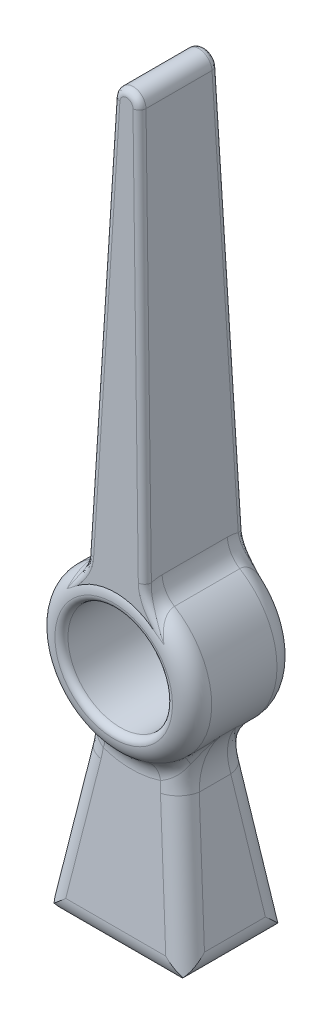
SolidWorks part; units mm, degrees
ref_plane "Спереди" through (0, 0, 0) normal (0, 0, 1) x (1, 0, 0)
ref_plane "Сверху" through (0, 0, 0) normal (0, 1, 0) x (1, 0, 0)
ref_plane "Справа" through (0, 0, 0) normal (1, 0, 0) x (0, 0, -1)
sketch "Эскиз1" plane through (0, 0, 0) normal (0, 0, 1) x (1, 0, 0)
  circle A0 centre (0, 0) radius 4 construction
  circle A1 centre (0, 0) radius 6
  dimension "D1" = 8
  dimension "D2" = 12
extrude "Бобышка-Вытянуть1" add sketch "Эскиз1" along normal mid plane 8
fillet "Скругление1" radius 1.5 2 edges at (6, 0, -4) (6, 0, 4)
sketch "Эскиз3" plane through (0, 0, 0) normal (0, 0, 1) x (1, 0, 0)
  line L0 (0, 0) -> (0, 38) construction
  line L1 (2.471, 0) -> (-2.471, 0)
  line L2 (-2.471, 0) -> (-0.9992, 37.0397)
  line L3 (-2.25, 5.5621) -> (0, 5.5621) construction
  line L4 (2.471, 0) -> (0.9992, 37.0397)
  circle A0 centre (0, 0) radius 6 construction
  circle A1 centre (0, 0) radius 6 construction
  arc A2 (0.9992, 37.0397) -> (-0.9992, 37.0397) centre (0, 37) ccw
  dimension "D1" = 2
  dimension "D2" = 38
  dimension "D3" = 4.5
extrude "Бобышка-Вытянуть2" add sketch "Эскиз3" along normal mid plane 8 separate body
sketch "Эскиз4" plane through (0, 0, 0) normal (1, 0, 0) x (0, 0, -1)
  line L0 (-4, 0) -> (-3, 38)
  line L1 (-4, 4.5) -> (-4, -4.5) construction
  line L2 (4, 38) -> (-4, 38) construction
  line L3 (-3, 38) -> (-4, 38)
  line L4 (-4, 38) -> (-4, 0)
  line L5 (0, 0) -> (0, 38) construction
  line L6 (4, 0) -> (3, 38)
  line L7 (4, 38) -> (4, 0)
  line L8 (3, 38) -> (4, 38)
  dimension "D1" = 6
extrude "Вырез-Вытянуть1" cut sketch "Эскиз4" against normal mid plane 8
combine bodies "Соединить1" operation type add bodies to combine 104 101
fillet "Скругление3" radius 2 3 edges at (2.25, 5.5621, 0) (2.2622, 5.2554, -3.3704) (2.2642, 5.2036, 3.4326)
fillet "Скругление4" radius 2 3 edges at (-2.25, 5.5621, 0) (-2.2642, 5.2036, -3.4326) (-2.2622, 5.2554, 3.3704)
fillet "Скругление5" radius 0.5 10 edges at (2.4238, 5.4513, -3.8565) (-2.4372, 5.417, -3.8574) (-1.6078, 21.7242, -3.4283) (0, 38, -3) (-2.4238, 5.4513, 3.8565) (-1.6078, 21.7242, 3.4283) (0, 38, 3) (2.4372, 5.417, 3.8574) (1.6078, 21.7242, -3.4283) (1.6078, 21.7242, 3.4283)
sketch "Эскиз5" plane through (0, 0, 0) normal (1, 0, 0) x (0, 0, -1)
  line L0 (-4, 4.5) -> (-4, -4.5) construction
  line L1 (-4, -18.3693) -> (-1.7724, 0)
  line L2 (0, 0) -> (0, -19) construction
  line L3 (-1.7724, 0) -> (1.7724, 0)
  line L4 (4, -18.3693) -> (1.7724, 0)
  line L6 (-2.5, -6) -> (2.5, -6) construction
  arc A0 (-4, -18.3693) -> (4, -18.3693) centre (0, -6) ccw
  point P8 (-2.5, -6)
  dimension "D1" = 13
  dimension "D3" = 19
extrude "Бобышка-Вытянуть3" add sketch "Эскиз5" along normal mid plane 11 separate body
sketch "Эскиз7" plane through (0, 0, 0) normal (0, 0, 1) x (1, 0, 0)
  line L0 (-5.5, -18.1865) -> (-3.7552, -7.555)
  line L1 (-2.5153, 0) -> (2.5153, 0)
  line L2 (0, 0) -> (0, -19) construction
  line L3 (0, -6) -> (-3.5, -6) construction
  line L4 (5.5, -18.1865) -> (3.7552, -7.555)
  line L5 (-5.5, 0) -> (-5.5, -18.3693) construction
  line L6 (5.5, 0) -> (5.5, -18.3693) construction
  line L7 (-2.5153, 0) -> (-4.7396, -3.6792)
  line L8 (2.5153, 0) -> (4.7396, -3.6792)
  arc A0 (-5.5, -18.1865) -> (5.5, -18.1865) centre (0, 0) ccw
  arc A1 (-3.1516, 5.1056) -> (3.1516, 5.1056) centre (0, 0) ccw construction
  arc A2 (-3.1516, 5.1056) -> (3.1516, 5.1056) centre (0, 0) ccw construction
  arc A3 (-3.7552, -7.555) -> (-4.7396, -3.6792) centre (-8.6892, -6.7452) ccw
  arc A4 (3.7552, -7.555) -> (4.7396, -3.6792) centre (8.6892, -6.7452) cw
  dimension "D1" = 38
  dimension "D3" = 10
  dimension "D2" = 7
extrude "Вырез-Вытянуть2" cut sketch "Эскиз7" against normal mid plane 10 flip side to cut
combine bodies "Соединить2" operation type add bodies to combine 105 108
fillet "Скругление8" radius 1.5 12 edges at (3.843, -5.5144, -2.4411) (-3.843, -5.5144, -2.4411) (-3.843, -5.5144, 2.4411) (3.843, -5.5144, 2.4411) (-5.5, -18.1865, 0) (5.5, -18.1865, 0) (0, -18.3693, -4) (0, -18.3693, 4) (4.6276, -12.8707, -3.3332) (-4.6276, -12.8707, -3.3332) (-4.6276, -12.8707, 3.3332) (4.6276, -12.8707, 3.3332)
fillet "Скругление9" radius 1.5 5 edges at (-1.1557, -5.8876, 2.4864) (1.1557, -5.8876, 2.4864) (-2.1892, -6.5863, 2.5711) (-2.9388, -5.231, 2.2833) (2.9388, -5.231, 2.2833)
fillet "Скругление10" radius 1.5 5 edges at (1.1557, -5.8876, -2.4864) (-1.1557, -5.8876, -2.4864) (2.1892, -6.5863, -2.5711) (2.9388, -5.231, -2.2833) (-2.9388, -5.231, -2.2833)
sketch "Эскиз8" plane through (0, 0, 0) normal (0, 0, 1) x (1, 0, 0)
  circle A0 centre (0, 0) radius 4 construction
  circle A1 centre (0, 0) radius 4
extrude "Вырез-Вытянуть3" cut sketch "Эскиз8" against normal mid plane 10
fillet "Скругление11" radius 0.5 2 edges at (4, 0, -4) (4, 0, 4)
